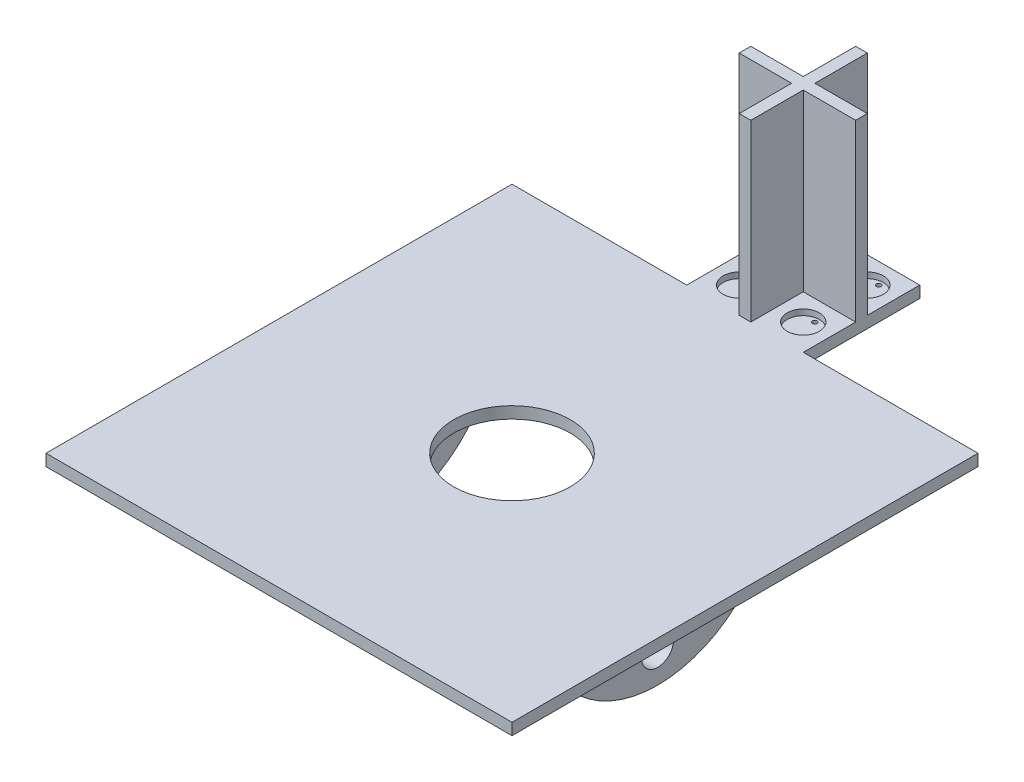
SolidWorks part; units mm, degrees
ref_plane "Front Plane" through (0, 0, 0) normal (0, 0, 1) x (1, 0, 0)
ref_plane "Top Plane" through (0, 0, 0) normal (0, 1, 0) x (1, 0, 0)
ref_plane "Right Plane" through (0, 0, 0) normal (1, 0, 0) x (0, 0, -1)
sketch "Sketch1" plane through (0, 0, 0) normal (0, 1, 0) x (1, 0, 0)
  line L0 (0, 101.6) -> (38.1, 101.6)
  line L1 (0, 0) -> (101.6, 0)
  line L2 (0, 0) -> (0, 101.6)
  line L4 (101.6, 0) -> (101.6, 101.6)
  line L6 (38.1, 101.6) -> (38.1, 127)
  line L7 (38.1, 127) -> (63.5, 127)
  line L8 (63.5, 101.6) -> (63.5, 127)
  line L13 (63.5, 101.6) -> (101.6, 101.6)
  line L14 (0, 101.6) -> (101.6, 0) construction
  circle A0 centre (50.8, 50.8) radius 12.7
  dimension "D7" = 25.4
  dimension "D1" = 38.1
  dimension "D2" = 101.6
  dimension "D3" = 101.6
  dimension "D4" = 101.6
  dimension "D5" = 38.1
  dimension "D6" = 25.4
extrude "Boss-Extrude2" add sketch "Sketch1" along normal blind 2.54
sketch "Sketch2" plane through (0, 2.54, 0) normal (0, 1, 0) x (1, 0, 0)
  line L0 (38.1, 101.6) -> (63.5, 127) construction
  line L1 (63.5, 127) -> (38.1, 127) construction
  line L2 (52.07, 101.6) -> (49.53, 101.6)
  line L4 (52.07, 127) -> (49.53, 127)
  line L6 (38.1, 115.57) -> (49.53, 115.57)
  line L7 (49.53, 115.57) -> (49.53, 127)
  line L8 (63.5, 101.6) -> (63.5, 127) construction
  line L10 (38.1, 113.03) -> (38.1, 115.57)
  line L12 (63.5, 113.03) -> (63.5, 115.57)
  line L13 (52.07, 127) -> (52.07, 115.57)
  line L14 (52.07, 115.57) -> (63.5, 115.57)
  line L15 (63.5, 113.03) -> (52.07, 113.03)
  line L16 (52.07, 113.03) -> (52.07, 101.6)
  line L17 (49.53, 101.6) -> (49.53, 113.03)
  line L18 (49.53, 113.03) -> (38.1, 113.03)
  point P4 (50.8, 114.3)
  point P11 (50.8, 114.3)
  dimension "D1" = 2.54
  dimension "D2" = 2.54
extrude "Boss-Extrude4" add sketch "Sketch2" along normal blind 38.1
sketch "Sketch7" plane through (0, 0, 0) normal (0, -1, 0) x (1, 0, 0)
  line L0 (0, -101.6) -> (0, 0) construction
  line L1 (22.05, -25.4) -> (19.05, -25.4)
  line L2 (22.05, -25.4) -> (22.05, -76.2)
  line L3 (22.05, -76.2) -> (19.05, -76.2)
  line L4 (19.05, -25.4) -> (19.05, -76.2)
  line L5 (82.55, -25.4) -> (79.55, -25.4)
  line L6 (82.55, -25.4) -> (82.55, -76.2)
  line L7 (82.55, -76.2) -> (79.55, -76.2)
  line L8 (79.55, -25.4) -> (79.55, -76.2)
  line L9 (101.6, 0) -> (101.6, -101.6) construction
  line L10 (38.1, -101.6) -> (0, -101.6) construction
  line L11 (101.6, -101.6) -> (63.5, -101.6) construction
  dimension "D1" = 50.8
  dimension "D2" = 50.8
  dimension "D3" = 3
  dimension "D4" = 3
  dimension "D5" = 19.05
  dimension "D6" = 19.05
  dimension "D7" = 25.4
  dimension "D8" = 25.4
extrude "Boss-Extrude5" add sketch "Sketch7" along normal blind 25.4
sketch "Sketch8" plane through (19.05, 0, 0) normal (-1, 0, 0) x (0, 0, 1)
  line L0 (-76.2, 0) -> (-76.2, -25.4)
  line L1 (-76.2, -25.4) -> (-25.4, -25.4)
  line L2 (-25.4, -25.4) -> (-25.4, 0)
  arc A0 (-76.2, 0) -> (-25.4, 0) centre (-50.8, 0) ccw
  circle A1 centre (-50.8, -18.5233) radius 3.5
  dimension "D1" = 7
extrude "Cut-Extrude5" cut sketch "Sketch8" against normal through all both and the other way through all contours A0 M2 M3 | A0 L1 M4 | A1
sketch "Sketch9" plane through (82.55, 0, 0) normal (1, 0, 0) x (0, 0, -1)
  line L0 (50.8, -18.5233) -> (50.8, -7.5233) construction
  circle A0 centre (50.8, -7.5233) radius 0.75
  dimension "D2" = 1.5
  dimension "D1" = 11
extrude "Cut-Extrude6" cut sketch "Sketch9" against normal up to next
sketch "Sketch10" plane through (0, 2.54, 0) normal (0, 1, 0) x (1, 0, 0)
  line L0 (38.1, 101.6) -> (49.53, 113.03) construction
  line L1 (38.1, 127) -> (49.53, 115.57) construction
  line L2 (52.07, 115.57) -> (63.5, 127) construction
  line L3 (52.07, 101.6) -> (63.5, 113.03) construction
  circle A0 centre (43.815, 121.285) radius 3.5
  circle A1 centre (43.815, 107.315) radius 3.5
  circle A2 centre (57.785, 107.315) radius 3.5
  circle A3 centre (57.785, 121.285) radius 3.5
  dimension "D1" = 7
  dimension "D2" = 7
  dimension "D3" = 7
  dimension "D4" = 7
extrude "Cut-Extrude7" cut sketch "Sketch10" against normal blind 1.27
sketch "Sketch11" plane through (0, 1.27, 0) normal (0, 1, 0) x (1, 0, 0)
  line L0 (43.815, 117.785) -> (43.815, 124.785) construction
  line L1 (43.815, 103.815) -> (43.815, 110.815) construction
  line L2 (57.785, 103.815) -> (57.785, 110.815) construction
  line L3 (57.785, 117.785) -> (57.785, 124.785) construction
  circle A0 centre (43.815, 121.285) radius 3.5
  circle A1 centre (43.815, 123.785) radius 0.5
  circle A2 centre (43.815, 118.785) radius 0.5
  circle A3 centre (43.815, 107.315) radius 3.5
  circle A4 centre (43.815, 109.815) radius 0.5
  circle A5 centre (43.815, 104.815) radius 0.5
  circle A6 centre (43.815, 107.315) radius 3.5 construction
  circle A7 centre (57.785, 107.315) radius 3.5
  circle A8 centre (57.785, 109.815) radius 0.5
  circle A9 centre (57.785, 104.815) radius 0.5
  circle A10 centre (57.785, 121.285) radius 3.5
  circle A11 centre (57.785, 123.785) radius 0.5
  circle A12 centre (57.785, 118.785) radius 0.5
  circle A13 centre (57.785, 121.285) radius 3.5 construction
  circle A14 centre (57.785, 107.315) radius 3.5 construction
  dimension "D2" = 1
  dimension "D4" = 1
  dimension "D5" = 7
  dimension "D7" = 1
  dimension "D9" = 1
  dimension "D10" = 7
  dimension "D12" = 1
  dimension "D14" = 1
  dimension "D15" = 7
  dimension "D17" = 1
  dimension "D19" = 1
  dimension "D20" = 7
  dimension "D1" = 1
  dimension "D3" = 1
  dimension "D6" = 1
  dimension "D8" = 1
  dimension "D11" = 1
  dimension "D13" = 1
  dimension "D16" = 1
  dimension "D18" = 1
extrude "Cut-Extrude9" cut sketch "Sketch11" against normal blind 1.27 contours A2 | A5 | A4 | A8 | A12 | A11 | A1 | A9
